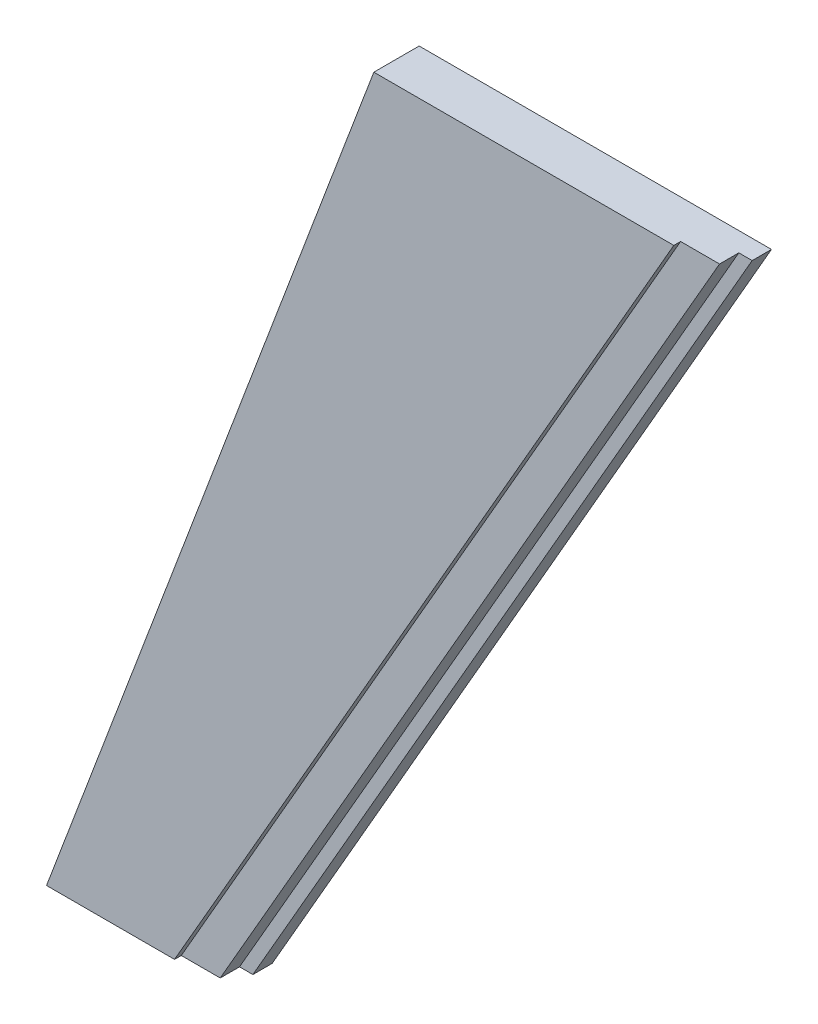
SolidWorks part; units mm, degrees
ref_plane "Спереди" through (0, 0, 0) normal (0, 0, 1) x (1, 0, 0)
ref_plane "Сверху" through (0, 0, 0) normal (0, 1, 0) x (1, 0, 0)
ref_plane "Справа" through (0, 0, 0) normal (1, 0, 0) x (0, 0, -1)
sketch "Эскиз1" plane through (0, 0, 0) normal (0, 0, 1) x (1, 0, 0)
  line L5 (-620.7803, 0) -> (-931.8468, 0)
  line L6 (-1271.2097, -900) -> (-1138.4871, -900)
  line L19 (-620.7803, 0) -> (-1138.4871, -900)
  line L20 (-931.8468, 0) -> (-1271.2097, -900)
extrude "Вытянуть1" add sketch "Эскиз1" along normal blind 47
sketch "Эскиз2" plane through (0, 0, 0) normal (0, 0, -1) x (-1, 0, 0)
  line L0 (620.7803, 0) -> (580.4028, 0)
  line L1 (1138.4871, -900) -> (1098.1096, -900)
  line L2 (1098.1096, -900) -> (580.4028, 0)
  line L3 (1138.4871, -900) -> (620.7803, 0) construction
  line L8 (620.7803, 0) -> (1138.4871, -900)
  line L9 (1138.4871, -900) -> (1271.2097, -900)
  line L10 (1271.2097, -900) -> (931.8468, 0)
  line L11 (931.8468, 0) -> (620.7803, 0)
  line L12 (620.7803, 0) -> (1138.4871, -900)
  dimension "D1" = 35
  dimension "D2" = 0
extrude "Вытянуть2" add sketch "Эскиз2" against normal blind 40
sketch "Эскиз3" plane through (0, 0, 0) normal (0, 0, -1) x (-1, 0, 0)
  line L0 (580.4028, 0) -> (566.5591, 0)
  line L1 (1098.1096, -900) -> (1084.2659, -900)
  line L2 (1084.2659, -900) -> (566.5591, 0)
  line L3 (580.4028, 0) -> (1098.1096, -900) construction
  line L8 (931.8468, 0) -> (580.4028, 0)
  line L9 (580.4028, 0) -> (1098.1096, -900)
  line L10 (1098.1096, -900) -> (1271.2097, -900)
  line L11 (1271.2097, -900) -> (931.8468, 0)
  line L13 (580.4028, 0) -> (1098.1096, -900)
  dimension "D1" = 12
  dimension "D2" = 0
extrude "Вытянуть3" add sketch "Эскиз3" against normal blind 20
